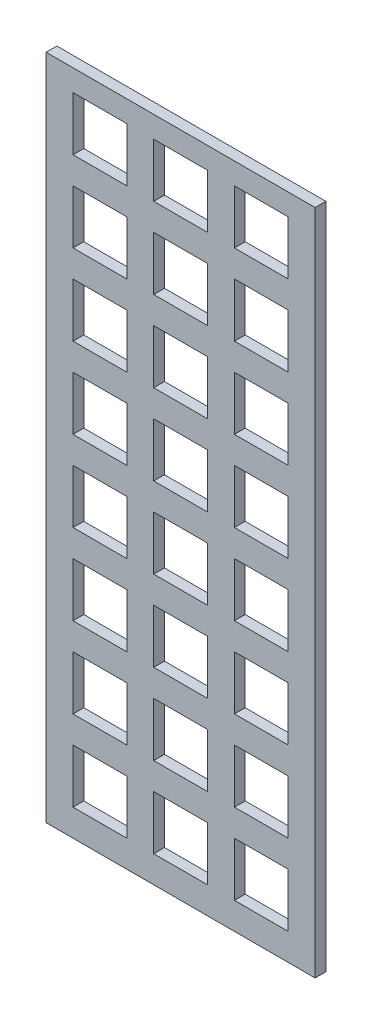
SolidWorks part; units mm, degrees
ref_plane "Front Plane" through (0, 0, 0) normal (0, 0, 1) x (1, 0, 0)
ref_plane "Top Plane" through (0, 0, 0) normal (0, 1, 0) x (1, 0, 0)
ref_plane "Right Plane" through (0, 0, 0) normal (1, 0, 0) x (0, 0, -1)
sketch "Sketch1" plane through (0, 0, 0) normal (0, 0, 1) x (1, 0, 0)
  line L1 (0, 0) -> (25, 0)
  line L2 (0, 0) -> (0, 62)
  line L3 (0, 62) -> (25, 62)
  line L4 (25, 0) -> (25, 62)
  dimension "D1" = 62
  dimension "D2" = 25
extrude "Extrude1" add sketch "Sketch1" along normal blind 1
sketch "Sketch2" plane through (0, 0, 1) normal (0, 0, 1) x (1, 0, 0)
  line L0 (25, 31) -> (0, 31) construction
  line L1 (25, 0) -> (25, 62) construction
  line L2 (0, 62) -> (0, 0) construction
  line L3 (0, 0) -> (25, 0) construction
  line L4 (22.5, 2.5) -> (17.5, 2.5)
  line L5 (22.5, 2.5) -> (22.5, 7.5)
  line L6 (22.5, 7.5) -> (17.5, 7.5)
  line L7 (17.5, 2.5) -> (17.5, 7.5)
  line L8 (15, 7.5) -> (10, 7.5)
  line L9 (15, 2.5) -> (15, 7.5)
  line L10 (15, 2.5) -> (10, 2.5)
  line L11 (10, 2.5) -> (10, 7.5)
  line L12 (7.5, 7.5) -> (2.5, 7.5)
  line L13 (7.5, 2.5) -> (7.5, 7.5)
  line L14 (7.5, 2.5) -> (2.5, 2.5)
  line L15 (2.5, 2.5) -> (2.5, 7.5)
  line L16 (22.5, 15) -> (17.5, 15)
  line L17 (22.5, 10) -> (22.5, 15)
  line L18 (22.5, 10) -> (17.5, 10)
  line L19 (17.5, 10) -> (17.5, 15)
  line L20 (15, 15) -> (10, 15)
  line L21 (15, 10) -> (15, 15)
  line L22 (15, 10) -> (10, 10)
  line L23 (10, 10) -> (10, 15)
  line L24 (7.5, 15) -> (2.5, 15)
  line L25 (7.5, 10) -> (7.5, 15)
  line L26 (7.5, 10) -> (2.5, 10)
  line L27 (2.5, 10) -> (2.5, 15)
  line L28 (22.5, 22.5) -> (17.5, 22.5)
  line L29 (22.5, 17.5) -> (22.5, 22.5)
  line L30 (22.5, 17.5) -> (17.5, 17.5)
  line L31 (17.5, 17.5) -> (17.5, 22.5)
  line L32 (15, 22.5) -> (10, 22.5)
  line L33 (15, 17.5) -> (15, 22.5)
  line L34 (15, 17.5) -> (10, 17.5)
  line L35 (10, 17.5) -> (10, 22.5)
  line L36 (7.5, 22.5) -> (2.5, 22.5)
  line L37 (7.5, 17.5) -> (7.5, 22.5)
  line L38 (7.5, 17.5) -> (2.5, 17.5)
  line L39 (2.5, 17.5) -> (2.5, 22.5)
  line L40 (22.5, 30) -> (17.5, 30)
  line L41 (22.5, 25) -> (22.5, 30)
  line L42 (22.5, 25) -> (17.5, 25)
  line L43 (17.5, 25) -> (17.5, 30)
  line L44 (15, 30) -> (10, 30)
  line L45 (15, 25) -> (15, 30)
  line L46 (15, 25) -> (10, 25)
  line L47 (10, 25) -> (10, 30)
  line L48 (7.5, 30) -> (2.5, 30)
  line L49 (7.5, 25) -> (7.5, 30)
  line L50 (7.5, 25) -> (2.5, 25)
  line L51 (2.5, 25) -> (2.5, 30)
  line L52 (22.5, 37.5) -> (17.5, 37.5)
  line L53 (22.5, 32.5) -> (22.5, 37.5)
  line L54 (22.5, 32.5) -> (17.5, 32.5)
  line L55 (17.5, 32.5) -> (17.5, 37.5)
  line L56 (15, 37.5) -> (10, 37.5)
  line L57 (15, 32.5) -> (15, 37.5)
  line L58 (15, 32.5) -> (10, 32.5)
  line L59 (10, 32.5) -> (10, 37.5)
  line L60 (7.5, 37.5) -> (2.5, 37.5)
  line L61 (7.5, 32.5) -> (7.5, 37.5)
  line L62 (7.5, 32.5) -> (2.5, 32.5)
  line L63 (2.5, 32.5) -> (2.5, 37.5)
  line L64 (22.5, 45) -> (17.5, 45)
  line L65 (22.5, 40) -> (22.5, 45)
  line L66 (22.5, 40) -> (17.5, 40)
  line L67 (17.5, 40) -> (17.5, 45)
  line L68 (15, 45) -> (10, 45)
  line L69 (15, 40) -> (15, 45)
  line L70 (15, 40) -> (10, 40)
  line L71 (10, 40) -> (10, 45)
  line L72 (7.5, 45) -> (2.5, 45)
  line L73 (7.5, 40) -> (7.5, 45)
  line L74 (7.5, 40) -> (2.5, 40)
  line L75 (2.5, 40) -> (2.5, 45)
  line L76 (22.5, 52.5) -> (17.5, 52.5)
  line L77 (22.5, 47.5) -> (22.5, 52.5)
  line L78 (22.5, 47.5) -> (17.5, 47.5)
  line L79 (17.5, 47.5) -> (17.5, 52.5)
  line L80 (15, 52.5) -> (10, 52.5)
  line L81 (15, 47.5) -> (15, 52.5)
  line L82 (15, 47.5) -> (10, 47.5)
  line L83 (10, 47.5) -> (10, 52.5)
  line L84 (7.5, 52.5) -> (2.5, 52.5)
  line L85 (7.5, 47.5) -> (7.5, 52.5)
  line L86 (7.5, 47.5) -> (2.5, 47.5)
  line L87 (2.5, 47.5) -> (2.5, 52.5)
  line L88 (22.5, 60) -> (17.5, 60)
  line L89 (22.5, 55) -> (22.5, 60)
  line L90 (22.5, 55) -> (17.5, 55)
  line L91 (17.5, 55) -> (17.5, 60)
  line L92 (15, 60) -> (10, 60)
  line L93 (15, 55) -> (15, 60)
  line L94 (15, 55) -> (10, 55)
  line L95 (10, 55) -> (10, 60)
  line L96 (7.5, 60) -> (2.5, 60)
  line L97 (7.5, 55) -> (7.5, 60)
  line L98 (7.5, 55) -> (2.5, 55)
  line L99 (2.5, 55) -> (2.5, 60)
  dimension "D1" = 5
  dimension "D2" = 5
  dimension "D3" = 2.5
  dimension "D4" = 2.5
extrude "Extrude2" cut sketch "Sketch2" against normal blind 1
